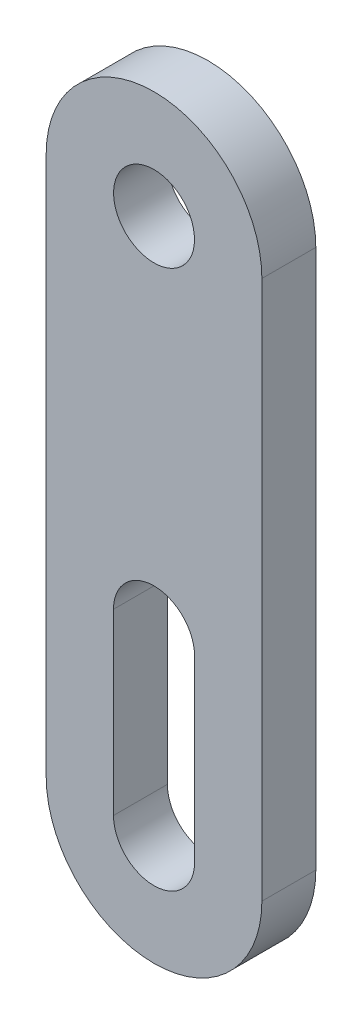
SolidWorks part; units mm, degrees
ref_plane "Plane1" through (0, 0, 0) normal (0, 0, 1) x (1, 0, 0)
ref_plane "Plane2" through (0, 0, 0) normal (0, 1, 0) x (1, 0, 0)
ref_plane "Plane3" through (0, 0, 0) normal (1, 0, 0) x (0, 0, -1)
sketch "Sketch1" plane through (0, 0, 0) normal (0, 0, 1) x (1, 0, 0)
  line L0 (0, 0) -> (17.9835, 0) construction
  line L1 (0, 6.35) -> (0, 38.1)
  line L2 (8.7376, 6.35) -> (8.7376, 16.8656)
  line L3 (12.7, 38.1) -> (12.7, 6.35)
  line L4 (8.7376, 11.6078) -> (28.7518, 11.6078) construction
  line L5 (6.35, 6.35) -> (6.35, 18.1922) construction
  line L6 (3.9624, 6.35) -> (3.9624, 16.8656)
  arc A0 (12.7, 6.35) -> (0, 6.35) centre (6.35, 6.35) cw
  arc A1 (12.7, 38.1) -> (0, 38.1) centre (6.35, 38.1) ccw
  circle A2 centre (6.35, 38.1) radius 2.3812
  arc A3 (3.9624, 6.35) -> (8.7376, 6.35) centre (6.35, 6.35) ccw
  arc A4 (3.9624, 16.8656) -> (8.7376, 16.8656) centre (6.35, 16.8656) cw
  point P6 (0, 0)
  point P21 (3.9624, 11.6078)
  dimension "D5" = 6.35
  dimension "D1" = 12.7
  dimension "D2" = 44.45
  dimension "D3" = 4.7625
  dimension "D4" = 2.3876
  dimension "D6" = 5.2578
extrude "Base-Extrude" add sketch "Sketch1" along normal blind 3.175
